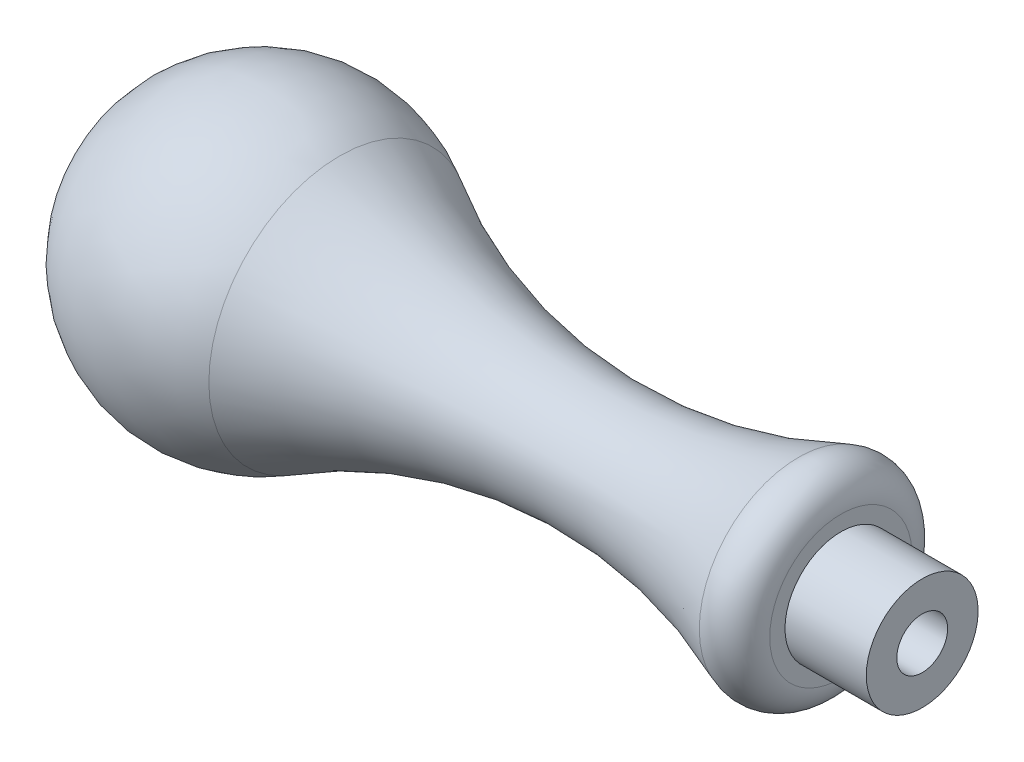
SolidWorks part; units mm, degrees
ref_plane "Front Plane" through (0, 0, 0) normal (0, 0, 1) x (1, 0, 0)
ref_plane "Top Plane" through (0, 0, 0) normal (0, 1, 0) x (1, 0, 0)
ref_plane "Right Plane" through (0, 0, 0) normal (1, 0, 0) x (0, 0, -1)
sketch "Sketch1" plane through (0, 0, 0) normal (0, 0, 1) x (1, 0, 0)
  line L0 (57, 7) -> (57, 5.5)
  line L1 (65, 2.5) -> (60, 2.5)
  line L2 (-15, 0) -> (79.5539, 0) construction
  line L3 (57, 5.5) -> (65, 5.5)
  line L4 (65, 5.5) -> (65, 2.5)
  line L5 (60, 2.5) -> (60, 0)
  line L6 (60, 0) -> (-15, 0)
  arc A0 (-15, 0) -> (7.6918, 12.8778) centre (0, 0) cw
  arc A2 (7.6918, 12.8778) -> (52.8301, 9.7625) centre (33.331, 55.8036) ccw
  arc A3 (52.8301, 9.7625) -> (57, 7) centre (54, 7) cw
  dimension "D1" = 15
  dimension "D3" = 50
  dimension "D5" = 3
  dimension "D8" = 7
  dimension "D2" = 8
  dimension "D4" = 5
  dimension "D6" = 3
  dimension "D7" = 2.5
  dimension "D9" = 75
revolve "Revolve1" add sketch "Sketch1" angle 360 about L2
